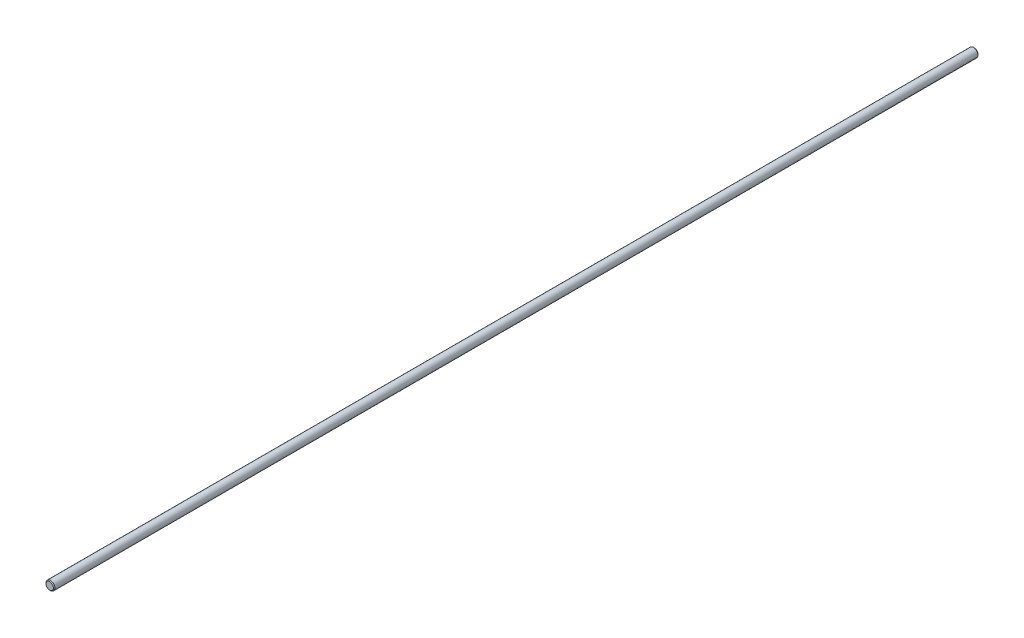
SolidWorks part; units mm, degrees
ref_plane "Front" through (0, 0, 0) normal (0, 0, 1) x (1, 0, 0)
ref_plane "Top" through (0, 0, 0) normal (0, 1, 0) x (1, 0, 0)
ref_plane "Right" through (0, 0, 0) normal (1, 0, 0) x (0, 0, -1)
sketch "Sketch1" plane through (0, 0, 0) normal (0, 0, 1) x (1, 0, 0)
  circle A0 centre (0, 0) radius 4.7625
  dimension "D1" = 9.525
extrude "Extrude1" add sketch "Sketch1" along normal blind 990.6
chamfer "Chamfer1" distance 0.7937 angle 45 2 edges at (4.7625, 0, 0) (4.7625, 0, 990.6)
